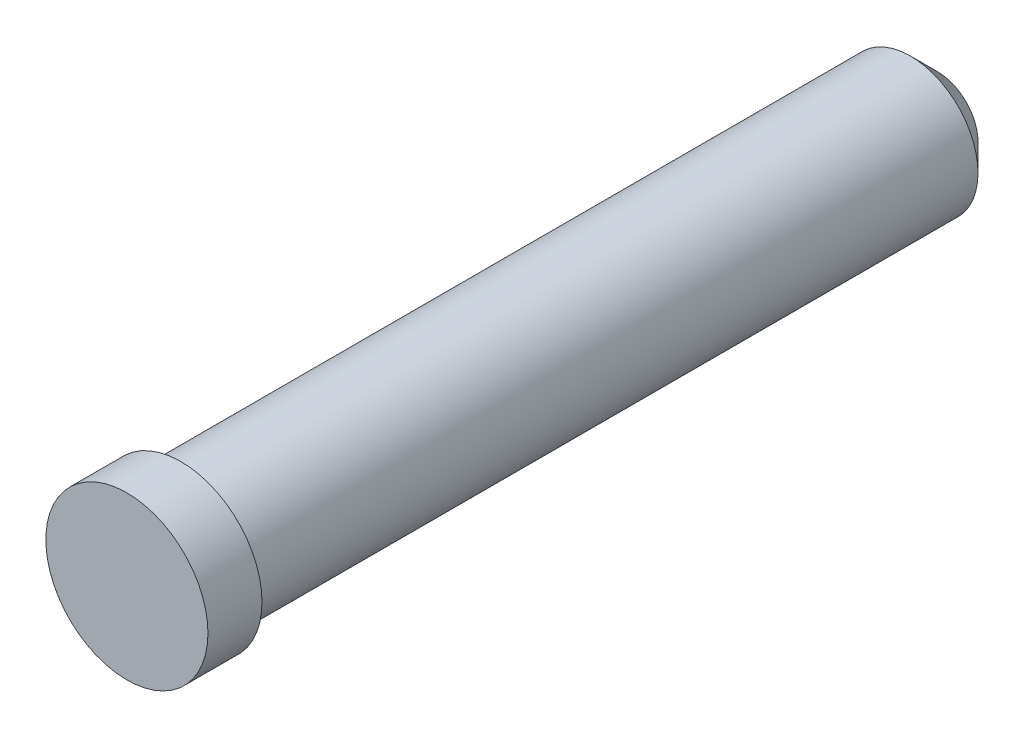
SolidWorks part; units mm, degrees
ref_plane "Plan1" through (0, 0, 0) normal (0, 0, 1) x (1, 0, 0)
ref_plane "Plan2" through (0, 0, 0) normal (0, 1, 0) x (1, 0, 0)
ref_plane "Plan3" through (0, 0, 0) normal (1, 0, 0) x (0, 0, -1)
sketch "Esquisse1" plane through (0, 0, 0) normal (0, 0, 1) x (1, 0, 0)
  circle A0 centre (0, 0) radius 2.5
  dimension "D1" = 5
extrude "Base-Extrusion" add sketch "Esquisse1" along normal blind 28
sketch "Esquisse2" plane through (0, 0, 28) normal (0, 0, 1) x (1, 0, 0)
  circle A0 centre (0, 0) radius 3
  dimension "D1" = 6
extrude "Boss.-Extru.1" add sketch "Esquisse2" along normal blind 2
chamfer "Chanfrein1" distance 1 angle 45 1 edges at (2.5, 0, 0)
